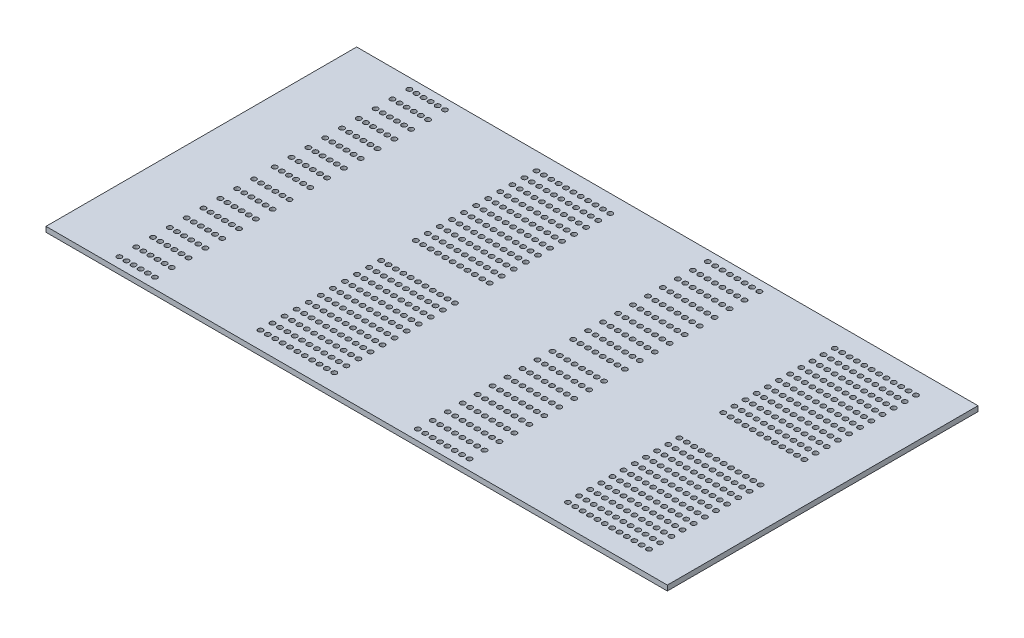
SolidWorks part; units mm, degrees
ref_plane "Plan de face" through (0, 0, 0) normal (0, 0, 1) x (1, 0, 0)
ref_plane "Plan de dessus" through (0, 0, 0) normal (0, 1, 0) x (1, 0, 0)
ref_plane "Plan de droite" through (0, 0, 0) normal (1, 0, 0) x (0, 0, -1)
sketch "Esquisse2" plane through (0, 0, 0) normal (0, 1, 0) x (1, 0, 0)
  line L1 (-60, -15) -> (60, -15)
  line L2 (-60, -15) -> (-60, 15)
  line L3 (-60, 15) -> (60, 15)
  line L4 (60, -15) -> (60, 15)
  line L5 (-60, -15) -> (60, 15) construction
  line L6 (-60, 15) -> (60, -15) construction
  point P0 (0, 0)
  dimension "D1" = 30
  dimension "D2" = 120
extrude "Boss.-Extru.1" add sketch "Esquisse2" along normal blind 1 contours L3 L4 L1 L2
sketch "Cavités" plane through (0, 0, 0) normal (0, 1, 0) x (1, 0, 0)
  line L0 (-60, -15) -> (60, -15) construction
  line L1 (-58.4, 15) -> (-30.4, 15) construction
  line L2 (-58.4, 15) -> (-58.4, -15) construction
  line L3 (-58.4, -15) -> (-30.4, -15) construction
  line L4 (-30.4, 15) -> (-30.4, -15) construction
  line L5 (-60, 15) -> (60, 15) construction
  line L6 (-28.8, 15) -> (-0.8, 15) construction
  line L7 (-28.8, 15) -> (-28.8, -15) construction
  line L8 (-28.8, -15) -> (-0.8, -15) construction
  line L9 (-0.8, 15) -> (-0.8, -15) construction
  line L10 (-30.4, 15) -> (-28.8, 15) construction
  line L11 (0.8, 15) -> (28.8, 15) construction
  line L12 (0.8, 15) -> (0.8, -15) construction
  line L13 (0.8, -15) -> (28.8, -15) construction
  line L14 (28.8, 15) -> (28.8, -15) construction
  line L15 (30.4, 15) -> (58.4, 15) construction
  line L16 (30.4, 15) -> (30.4, -15) construction
  line L17 (30.4, -15) -> (58.4, -15) construction
  line L18 (58.4, 15) -> (58.4, -15) construction
  line L19 (-0.8, 15) -> (0.8, 15) construction
  line L20 (28.8, 15) -> (30.4, 15) construction
  line L21 (-60, 15) -> (-58.4, 15) construction
  line L22 (58.4, 15) -> (60, 15) construction
  dimension "D1" = 28
  dimension "D2" = 1.6
sketch "Esquisse7" plane through (0, 1, 0) normal (0, 1, 0) x (1, 0, 0)
  line L0 (-58.4, 0) -> (-47.83, 0) construction
  line L1 (-47.83, 13) -> (-40.97, 13) construction
  line L2 (-47.83, 13) -> (-47.83, -13) construction
  line L3 (-47.83, -13) -> (-40.97, -13) construction
  line L4 (-40.97, 13) -> (-40.97, -13) construction
  line L5 (-58.4, 15) -> (-58.4, -15) construction
  line L6 (-40.97, 0) -> (-30.4, 0) construction
  line L7 (-30.4, 15) -> (-30.4, -15) construction
  dimension "D1" = 6.86
  dimension "D2" = 26
sketch "Esquisse8" plane through (0, 1, 0) normal (0, 1, 0) x (1, 0, 0)
  circle A0 centre (-47.83, 13) radius 0.475
  dimension "D1" = 0.95
extrude "Enlèv. mat.-Extru.3" cut sketch "Esquisse8" against normal up to next
pattern_linear "Répétition linéaire4" count 6 spacing 1.372 along (1, 0, 0) count 9 spacing 3.25 along (0, 0, 1) of "Enlèv. mat.-Extru.3"
sketch "Esquisse9" plane through (0, 1, 0) normal (0, 1, 0) x (1, 0, 0)
  line L0 (-28.8, 0) -> (-21.925, 0) construction
  line L1 (-21.925, 11.65) -> (-7.675, 11.65) construction
  line L2 (-21.925, 11.65) -> (-21.925, -11.65) construction
  line L3 (-21.925, -11.65) -> (-7.675, -11.65) construction
  line L4 (-7.675, 11.65) -> (-7.675, -11.65) construction
  line L5 (-28.8, 15) -> (-28.8, -15) construction
  line L6 (-7.675, 0) -> (-0.8, 0) construction
  line L7 (-0.8, 15) -> (-0.8, -15) construction
  dimension "D1" = 14.25
  dimension "D2" = 23.3
sketch "Esquisse10" plane through (0, 1, 0) normal (0, 1, 0) x (1, 0, 0)
  circle A0 centre (-21.925, 11.65) radius 0.475
  dimension "D1" = 0.95
extrude "Enlèv. mat.-Extru.4" cut sketch "Esquisse10" against normal up to next
pattern_linear "Répétition linéaire5" count 11 spacing 1.425 along (1, 0, 0) count 11 spacing 2.33 along (0, 0, 1) of "Enlèv. mat.-Extru.4"
sketch "Esquisse11" plane through (0, 1, 0) normal (0, 1, 0) x (1, 0, 0)
  line L0 (0.8, 0) -> (9.8125, 0) construction
  line L1 (9.8125, 13) -> (19.7875, 13) construction
  line L2 (9.8125, 13) -> (9.8125, -13) construction
  line L3 (9.8125, -13) -> (19.7875, -13) construction
  line L4 (19.7875, 13) -> (19.7875, -13) construction
  line L5 (0.8, 15) -> (0.8, -15) construction
  line L6 (19.7875, 0) -> (28.8, 0) construction
  line L7 (28.8, 15) -> (28.8, -15) construction
  dimension "D1" = 9.975
  dimension "D2" = 26
sketch "Esquisse12" plane through (0, 1, 0) normal (0, 1, 0) x (1, 0, 0)
  circle A0 centre (9.8125, 13) radius 0.475
  dimension "D1" = 0.95
extrude "Enlèv. mat.-Extru.5" cut sketch "Esquisse12" against normal up to next
pattern_linear "Répétition linéaire6" count 8 spacing 1.425 along (1, 0, 0) count 10 spacing 2.8889 along (0, 0, 1) of "Enlèv. mat.-Extru.5"
sketch "Esquisse13" plane through (0, 1, 0) normal (0, 1, 0) x (1, 0, 0)
  line L0 (30.4, 0) -> (36.5625, 0) construction
  line L1 (36.5625, 10.77) -> (52.2375, 10.77) construction
  line L2 (36.5625, 10.77) -> (36.5625, -10.77) construction
  line L3 (36.5625, -10.77) -> (52.2375, -10.77) construction
  line L4 (52.2375, 10.77) -> (52.2375, -10.77) construction
  line L5 (30.4, 15) -> (30.4, -15) construction
  line L6 (52.2375, 0) -> (58.4, 0) construction
  line L7 (58.4, 15) -> (58.4, -15) construction
  dimension "D1" = 21.54
  dimension "D2" = 15.675
sketch "Esquisse14" plane through (0, 1, 0) normal (0, 1, 0) x (1, 0, 0)
  circle A0 centre (36.5625, 10.77) radius 0.475
  dimension "D1" = 0.95
extrude "Enlèv. mat.-Extru.6" cut sketch "Esquisse14" against normal up to next
pattern_linear "Répétition linéaire7" count 12 spacing 1.425 along (1, 0, 0) count 11 spacing 2.154 along (0, 0, 1) of "Enlèv. mat.-Extru.6"
mirror "Symétrie1" about plane through (-60, 1, 15) normal (0, 0, -1)
